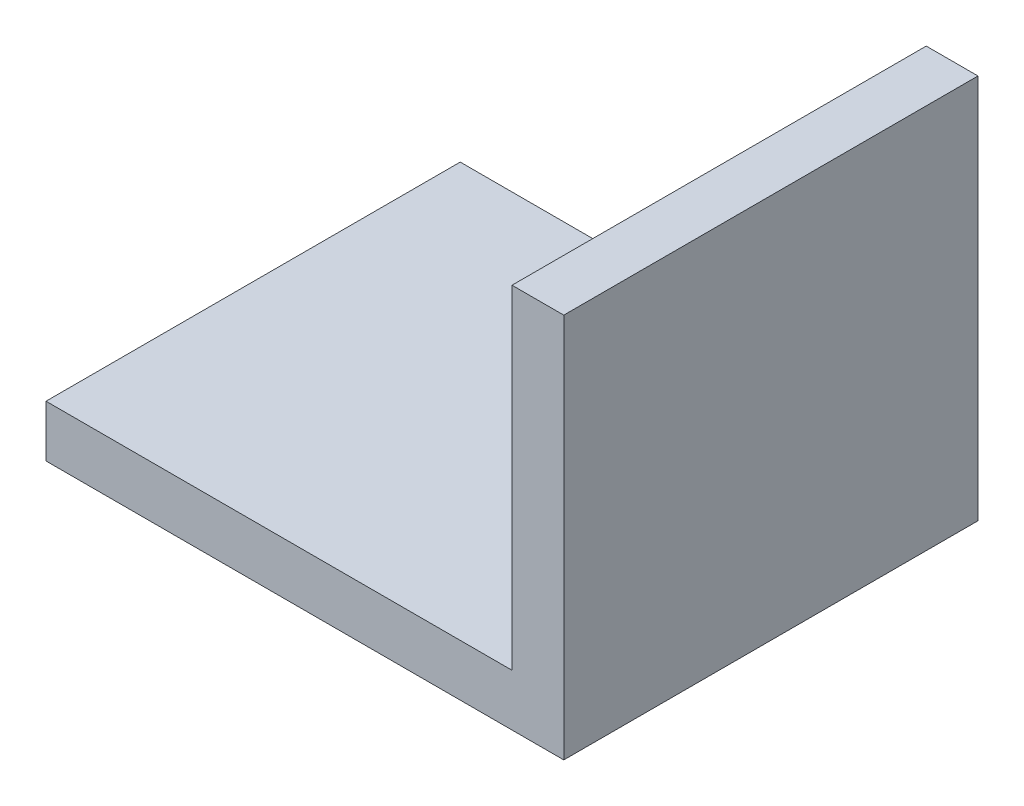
SolidWorks part; units mm, degrees
ref_plane "Front Plane" through (0, 0, 0) normal (0, 0, 1) x (1, 0, 0)
ref_plane "Top Plane" through (0, 0, 0) normal (0, 1, 0) x (1, 0, 0)
ref_plane "Right Plane" through (0, 0, 0) normal (1, 0, 0) x (0, 0, -1)
sketch "Sketch1" plane through (0, 0, 0) normal (0, 0, 1) x (1, 0, 0)
  line L0 (0, 0) -> (0, 25.4)
  line L1 (0, 25.4) -> (228.6, 25.4)
  line L2 (228.6, 25.4) -> (228.6, 188.976)
  line L3 (228.6, 188.976) -> (254, 188.976)
  line L4 (254, 188.976) -> (254, 0)
  line L5 (254, 0) -> (0, 0)
  dimension "D1" = 254
  dimension "D2" = 188.976
  dimension "D3" = 25.4
  dimension "D4" = 25.4
extrude "Boss-Extrude1" add sketch "Sketch1" along normal blind 203.2
